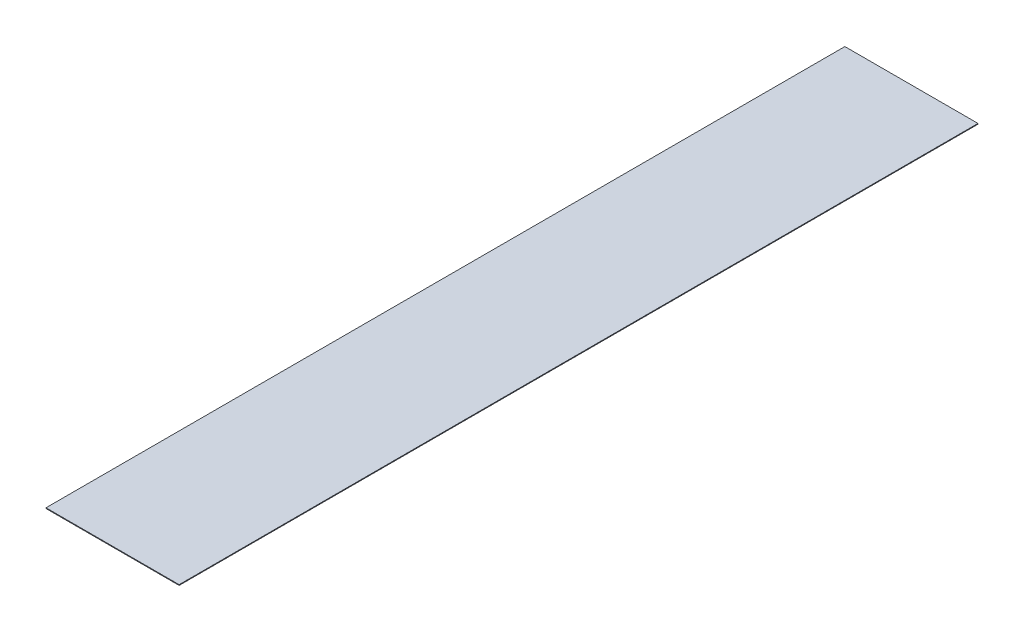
SolidWorks part; units mm, degrees
ref_plane "Face" through (0, 0, 0) normal (0, 0, 1) x (1, 0, 0)
ref_plane "Dessus" through (0, 0, 0) normal (0, 1, 0) x (1, 0, 0)
ref_plane "Droite" through (0, 0, 0) normal (1, 0, 0) x (0, 0, -1)
sketch "Esquisse1" plane through (0, 0, 0) normal (0, 1, 0) x (1, 0, 0)
  line L1 (0, 0) -> (95, 0)
  line L2 (0, 0) -> (0, 570)
  line L3 (0, 570) -> (95, 570)
  line L4 (95, 0) -> (95, 570)
  dimension "D1" = 95
  dimension "D2" = 570
extrude "Extrusion1" add sketch "Esquisse1" along normal blind 0.5
